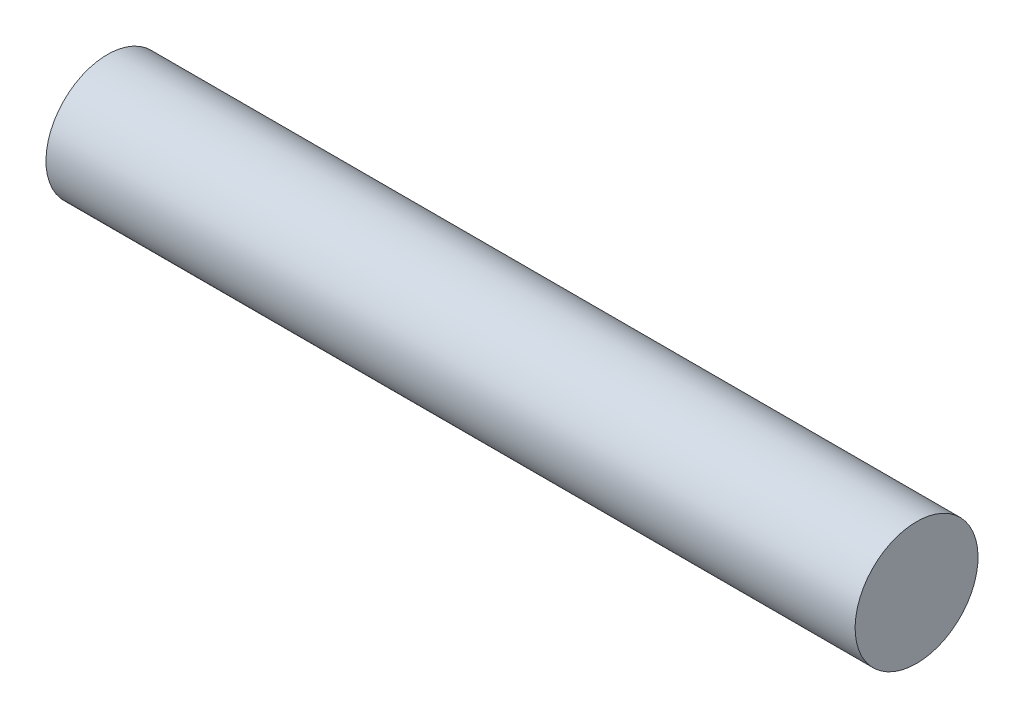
SolidWorks part; units mm, degrees
ref_plane "Front Plane" through (0, 0, 0) normal (0, 0, 1) x (1, 0, 0)
ref_plane "Top Plane" through (0, 0, 0) normal (0, 1, 0) x (1, 0, 0)
ref_plane "Right Plane" through (0, 0, 0) normal (1, 0, 0) x (0, 0, -1)
sketch "Sketch1" plane through (0, 0, 0) normal (0, 0, 1) x (1, 0, 0)
  line L0 (0, 0) -> (0, 8.128)
  line L1 (0, 8.128) -> (106.9975, 8.128)
  line L2 (106.9975, 8.128) -> (106.9975, 0)
  line L3 (106.9975, 0) -> (0, 0)
  line L4 (106.9975, 0) -> (0, 0) construction
  dimension "D1" = 8.128
  dimension "D2" = 106.9975
revolve "Revolve1" add sketch "Sketch1" angle 360 about L4
